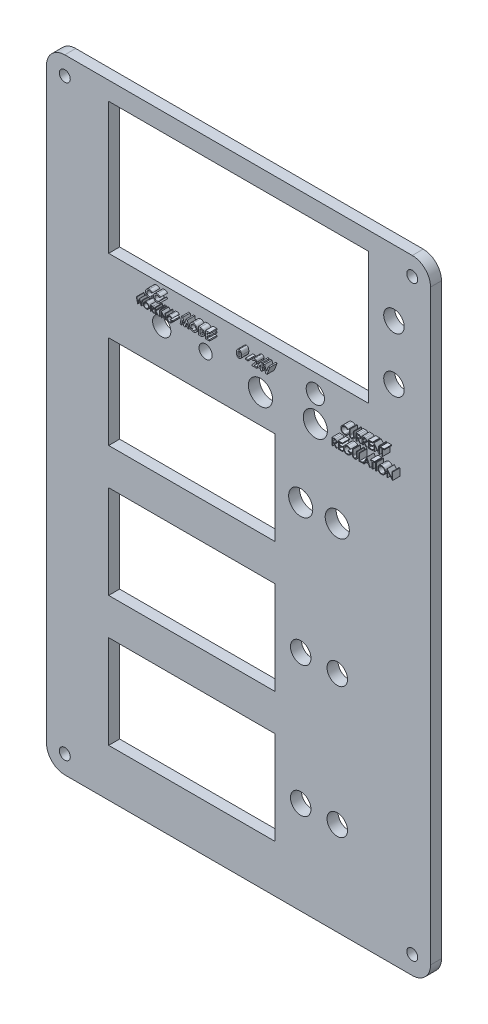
SolidWorks part; units mm, degrees
ref_plane "Front Plane" through (0, 0, 0) normal (0, 0, 1) x (1, 0, 0)
ref_plane "Top Plane" through (0, 0, 0) normal (0, 1, 0) x (1, 0, 0)
ref_plane "Right Plane" through (0, 0, 0) normal (1, 0, 0) x (0, 0, -1)
sketch "Croquis2" plane through (0, 0, 0) normal (0, 0, 1) x (1, 0, 0)
  line L1 (-47.5, 85.25) -> (47.5, 85.25)
  line L2 (-52.5, 80.25) -> (-52.5, -80.25)
  line L3 (-47.5, -85.25) -> (47.5, -85.25)
  line L4 (52.5, 80.25) -> (52.5, -80.25)
  line L5 (-52.5, 85.25) -> (52.5, -85.25) construction
  line L6 (-52.5, -85.25) -> (52.5, 85.25) construction
  arc A0 (-52.5, 80.25) -> (-47.5, 85.25) centre (-47.5, 80.25) cw
  arc A1 (52.5, 80.25) -> (47.5, 85.25) centre (47.5, 80.25) ccw
  arc A2 (-52.5, -80.25) -> (-47.5, -85.25) centre (-47.5, -80.25) ccw
  arc A3 (52.5, -80.25) -> (47.5, -85.25) centre (47.5, -80.25) cw
  point P0 (0, 0)
  dimension "D3" = 5
  dimension "D1" = 105
  dimension "D2" = 170.5
extrude "Saliente-Extruir1" add sketch "Croquis2" along normal blind 3 contours L1 A1 L4 A3 L3 A2 L2 A0
sketch "Croquis3" plane through (0, 0, 3) normal (0, 0, 1) x (1, 0, 0)
  line L0 (-52.5, 80.25) -> (-52.5, -80.25) construction
  line L1 (-35.5, 44.25) -> (35.5, 44.25)
  line L2 (-35.5, 44.25) -> (-35.5, 80.25)
  line L3 (-35.5, 80.25) -> (35.5, 80.25)
  line L4 (35.5, 44.25) -> (35.5, 80.25)
  line L5 (-35.5, 44.25) -> (35.5, 80.25) construction
  line L6 (-35.5, 80.25) -> (35.5, 44.25) construction
  line L7 (52.5, 80.25) -> (52.5, -80.25) construction
  line L8 (-47.5, 85.25) -> (47.5, 85.25) construction
  point P0 (0, 62.25)
  dimension "D1" = 71
  dimension "D2" = 36
  dimension "D3" = 17
  dimension "D4" = 17
  dimension "D5" = 5
extrude "Cortar-Extruir1" cut sketch "Croquis3" against normal up to next contours L3 L4 L1 L2
sketch "Croquis6" plane through (0, 0, 3) normal (0, 0, 1) x (1, 0, 0)
  line L0 (-52.5, 80.25) -> (-52.5, -80.25) construction
  line L1 (-35.5, 24.25) -> (10, 24.25)
  line L2 (-35.5, 24.25) -> (-35.5, -1.25)
  line L3 (-35.5, -1.25) -> (10, -1.25)
  line L4 (10, 24.25) -> (10, -1.25)
  line L5 (-35.5, 44.25) -> (35.5, 44.25) construction
  line L6 (-35.5, -11.25) -> (10, -11.25)
  line L7 (-35.5, -11.25) -> (-35.5, -36.75)
  line L8 (-35.5, -36.75) -> (10, -36.75)
  line L9 (10, -11.25) -> (10, -36.75)
  line L10 (-35.5, -46.75) -> (10, -46.75)
  line L11 (-35.5, -46.75) -> (-35.5, -72.25)
  line L12 (-35.5, -72.25) -> (10, -72.25)
  line L13 (10, -46.75) -> (10, -72.25)
  line L14 (52.5, 80.25) -> (52.5, -80.25) construction
  line L15 (35.5, 44.25) -> (35.5, 80.25) construction
  line L16 (-47.5, 85.25) -> (47.5, 85.25) construction
  circle A0 centre (21, 32.0985) radius 3.3
  circle A4 centre (17, -24) radius 2.8
  circle A5 centre (27, -24) radius 2.8
  circle A6 centre (17, -59.75) radius 2.8
  circle A7 centre (27, -59.75) radius 2.8
  circle A11 centre (-9, 34.25) radius 1.8
  circle A12 centre (42.5, 52.25) radius 2.8
  circle A13 centre (42.5, 67.25) radius 2.8
  circle A14 centre (6, 32.0985) radius 3.3
  circle A15 centre (21, 39.25) radius 2.5
  circle A16 centre (-21, 34.25) radius 2.5
  circle A17 centre (17, 11.5) radius 3.3
  circle A19 centre (27, 11.5) radius 3.3
  dimension "D10" = 6.6
  dimension "D11" = 17
  dimension "D12" = 31.5
  dimension "D13" = 45.5
  dimension "D17" = 15
  dimension "D18" = 6.6
  dimension "D19" = 6.6
  dimension "D20" = 12.75
  dimension "D21" = 7
  dimension "D22" = 10
  dimension "D24" = 7
  dimension "D28" = 12.5
  dimension "D29" = 3.6
  dimension "D30" = 10
  dimension "D32" = 5
  dimension "D33" = 5.6
  dimension "D34" = 0
  dimension "D35" = 5
  dimension "D36" = 15
  dimension "D37" = 7
  dimension "D38" = 7
  dimension "D39" = 18
  dimension "D41" = 10
  dimension "D42" = 5
  dimension "D16" = 6.6
  dimension "D31" = 15
  dimension "D43" = 12
  dimension "D45" = 7.1515
  dimension "D1" = 17
  dimension "D3" = 25.5
  dimension "D4" = 25.5
  dimension "D5" = 17
  dimension "D6" = 10
  dimension "D7" = 25.5
  dimension "D8" = 10
  dimension "D9" = 17
  dimension "D14" = 45.5
  dimension "D15" = 45.5
  dimension "D23" = 10
  dimension "D25" = 12.75
  dimension "D26" = 10
  dimension "D27" = 7
  dimension "D44" = 31.5
extrude "Cortar-Extruir2" cut sketch "Croquis6" against normal up to next
hole_wizard "Ø3.0mm Dowel Hole1" positions "Croquis3D1" profile "Croquis7" hole size "Ø3.0" standard "ISO"
sketch3d "Croquis3D1"
  line L0 (-52.5, 80.25, 3) -> (-52.5, -80.25, 3) construction
  line L1 (-47.5, 85.25, 3) -> (47.5, 85.25, 3) construction
  line L2 (52.5, 80.25, 3) -> (52.5, -80.25, 3) construction
  line L3 (-47.5, -85.25, 3) -> (47.5, -85.25, 3) construction
  point P0 (-47.5, 80.25, 3)
  point P7 (47.5, 80.25, 3)
  point P12 (47.5, -80.25, 3)
  point P17 (-47.5, -80.25, 3)
  dimension "D1" = 5
  dimension "D2" = 5
  dimension "D3" = 5
  dimension "D4" = 5
  dimension "D5" = 5
  dimension "D6" = 5
  dimension "D7" = 5
  dimension "D8" = 5
sketch "Croquis7" plane through (-47.5, 80.25, 3) normal (1, 0, 0) x (0, -1, 0)
  line L0 (0, 0) -> (0, 5)
  line L1 (0, 5) -> (1.5, 5)
  line L2 (1.5, 5) -> (1.5, 0)
  line L5 (1.5, 0) -> (0, 0)
  line L10 (0, 5) -> (-1.5, 5) construction
  line L11 (0, -6.35) -> (0, 107.95) construction
  dimension "Hole Dia." = 3
  dimension "Hole Depth" = 5
  dimension "Drill Angle" = 180
sketch "Croquis10" plane through (0, 0, 3) normal (0, 0, 1) x (1, 0, 0)
  line L0 (-27, 41.25) -> (-15, 41.25) construction
  line L1 (-14, 39.25) -> (-7, 39.25) construction
  line L2 (0, 39.25) -> (12, 39.25) construction
  line L3 (25.8511, 35.5985) -> (45.8511, 35.5985) construction
  line L4 (52.5, 80.25) -> (52.5, -80.25) construction
  line L5 (-27, 38.25) -> (-15, 38.25) construction
  circle A0 centre (-21, 34.25) radius 2.5 construction
  circle A2 centre (6, 32.0985) radius 3.3 construction
  circle A3 centre (21, 32.0985) radius 3.3 construction
  circle A5 centre (-9, 34.25) radius 1.8 construction
  dimension "D1" = 6
  dimension "D3" = 7
  dimension "D4" = 5
  dimension "D5" = 6
  dimension "D11" = 5
  dimension "D12" = 4
  dimension "D2" = 6
  dimension "D6" = 6
  dimension "D7" = 3.5
  dimension "D8" = 20
  dimension "D9" = 6.6489
  dimension "D10" = 7
  dimension "D13" = 6
sketch "Croquis11" plane through (0, 0, 3) normal (0, 0, 1) x (1, 0, 0)
  text T0 "CC   " font "Century Gothic" height 2
  text T1 "MODE" font "Century Gothic" height 2
  text T2 "0 - 24V" font "Century Gothic" height 2
  text T3 "CURRENT  REGULATION" font "Century Gothic" height 2
  text T4 "WORKING" font "Century Gothic" height 1.5
  point P1 (0, 0)
  point P2 (0, 0)
  point P3 (-31.6586, 39.5115)
extrude "Saliente-Extruir2" add sketch "Croquis11" along normal blind 2
